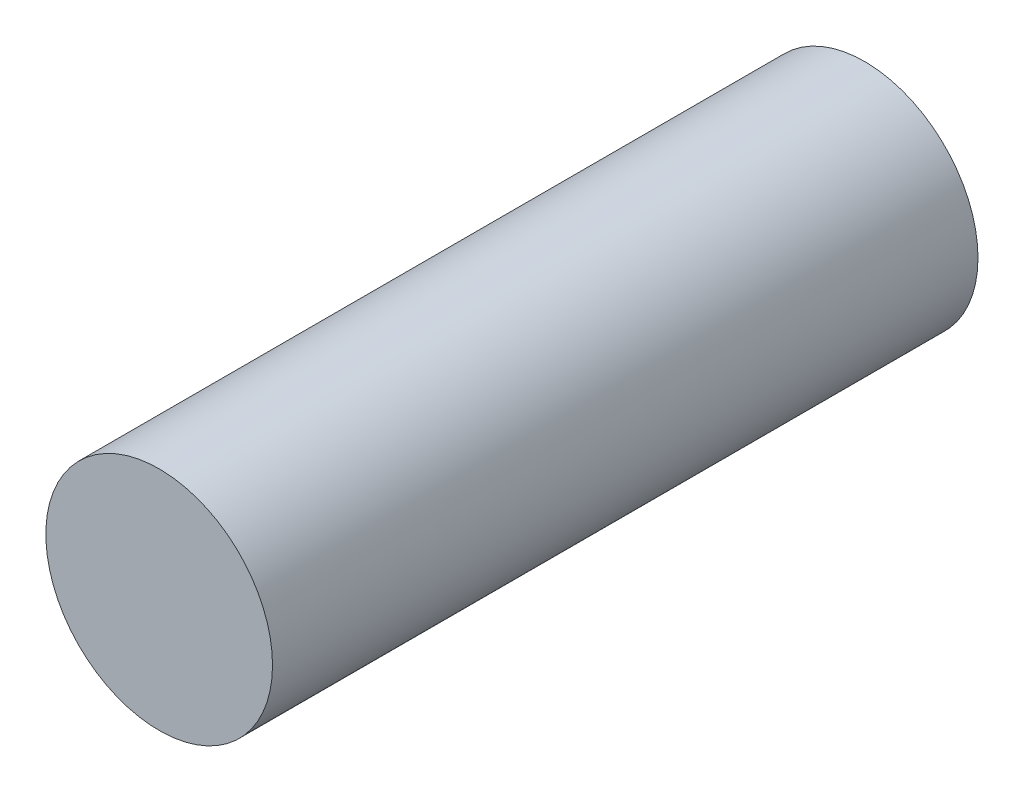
SolidWorks part; units mm, degrees
ref_plane "Front" through (0, 0, 0) normal (0, 0, 1) x (1, 0, 0)
ref_plane "Top" through (0, 0, 0) normal (0, 1, 0) x (1, 0, 0)
ref_plane "Right" through (0, 0, 0) normal (1, 0, 0) x (0, 0, -1)
sketch "Sketch1" plane through (0, 0, 0) normal (1, 0, 0) x (0, 0, -1)
  line L1 (0, 0) -> (277, 0)
  line L2 (0, 0) -> (0, 44.5)
  line L3 (0, 44.5) -> (277, 44.5)
  line L4 (277, 0) -> (277, 44.5)
  dimension "D1" = 44.5
  dimension "D2" = 277
revolve "Revolve1" add sketch "Sketch1" angle 360 about L1
